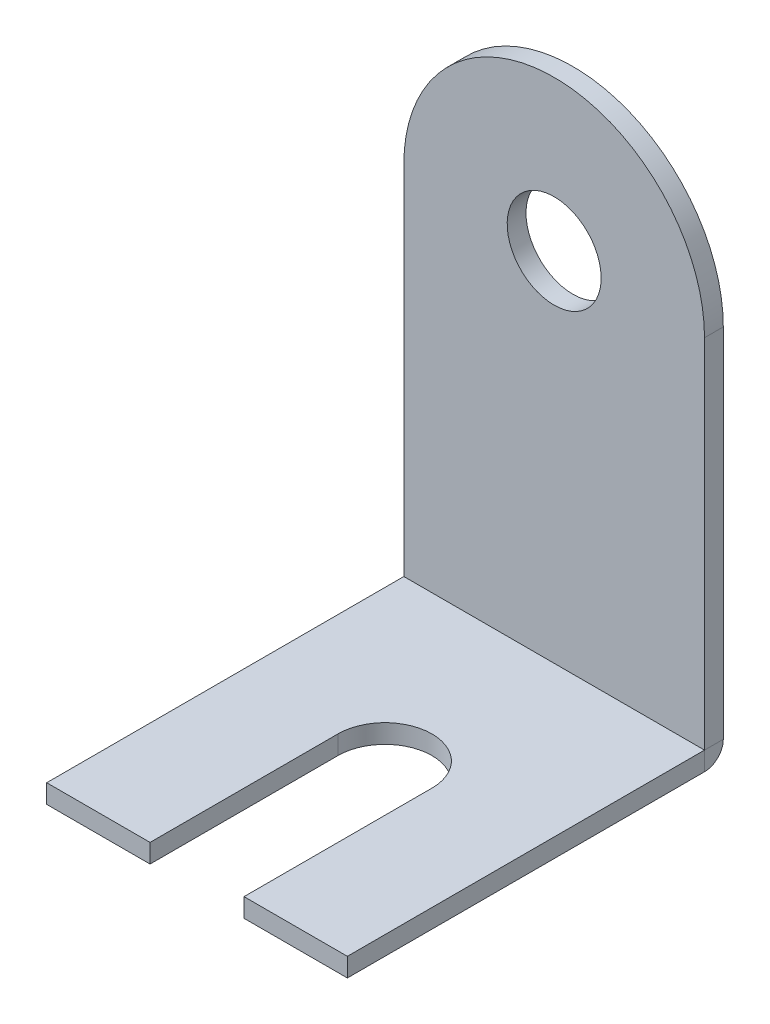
SolidWorks part; units mm, degrees
ref_plane "Front" through (0, 0, 0) normal (0, 0, 1) x (1, 0, 0)
ref_plane "Top" through (0, 0, 0) normal (0, 1, 0) x (1, 0, 0)
ref_plane "Right" through (0, 0, 0) normal (1, 0, 0) x (0, 0, -1)
sketch "Sketch1" plane through (0, 0, 0) normal (0, 1, 0) x (1, 0, 0)
  line L0 (5.5, 10) -> (5.5, 0)
  line L1 (0, 0) -> (5.5, 0)
  line L2 (0, 0) -> (0, 40)
  line L3 (10.5, 0) -> (16, 0)
  line L4 (16, 0) -> (16, 40)
  line L5 (10.5, 10) -> (10.5, 0)
  circle A0 centre (8, 40) radius 2.5
  arc A1 (10.5, 10) -> (5.5, 10) centre (8, 10) ccw
  arc A2 (16, 40) -> (0, 40) centre (8, 40) ccw
sheet metal parameters "Sheet-Metal1" thickness 1 parameters "D1"=0
base flange "Base-Flange1" sketch "Sketch1" thickness 1 reverse thickness direction yes parameters "D1"=0
sketch "Sketch3" plane through (0, 1, 0) normal (0, 1, 0) x (-1, 0, 0)
  line L1 (0, -20) -> (-16, -20)
sketched bend "Sketched Bend4" parameters "D1"=0
bend "SketchBend4" bend radius 0 bend angle 90 parameters "D5"=1
flat pattern "Flat-Pattern1"
sketch "Bend-Lines1" plane through (0, 1, 0) normal (0, 1, 0) x (-1, 0, 0)
  line L0 (0, -20) -> (-16, -20) construction
bend of the flat pattern "Flatten-<SketchBend4>1"
